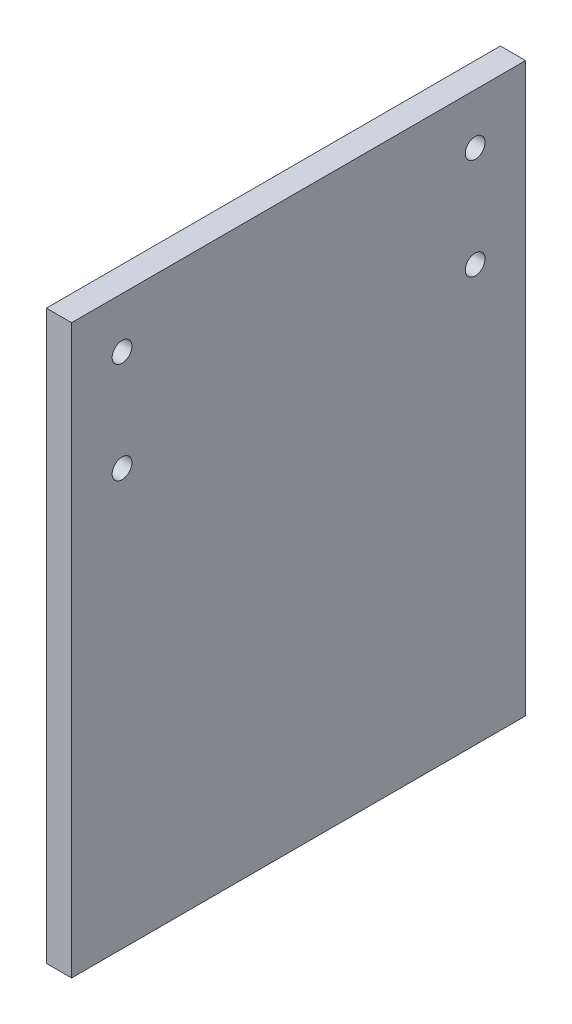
SolidWorks part; units mm, degrees
ref_plane "Front Plane" through (0, 0, 0) normal (0, 0, 1) x (1, 0, 0)
ref_plane "Top Plane" through (0, 0, 0) normal (0, 1, 0) x (1, 0, 0)
ref_plane "Right Plane" through (0, 0, 0) normal (1, 0, 0) x (0, 0, -1)
sketch "Sketch1" plane through (0, 0, 0) normal (1, 0, 0) x (0, 0, -1)
  line L1 (-57.15, 71.4375) -> (57.15, 71.4375)
  line L2 (-57.15, 71.4375) -> (-57.15, -71.4375)
  line L3 (-57.15, -71.4375) -> (57.15, -71.4375)
  line L4 (57.15, 71.4375) -> (57.15, -71.4375)
  line L5 (-57.15, 71.4375) -> (57.15, -71.4375) construction
  line L6 (-57.15, -71.4375) -> (57.15, 71.4375) construction
  point P0 (0, 0)
  dimension "D1" = 114.3
  dimension "D2" = 142.875
extrude "Boss-Extrude1" add sketch "Sketch1" along normal mid plane 6.35
hole_wizard "#10 Clearance Hole2" positions "Sketch3" profile "Sketch2" hole size "#10" standard "ANSI Inch"
sketch "Sketch3" plane through (3.175, 0, 0) normal (1, 0, 0) x (0, 0, -1)
  line L0 (57.15, 71.4375) -> (-57.15, 71.4375) construction
  line L1 (-57.15, 71.4375) -> (-57.15, -71.4375) construction
  line L2 (57.15, -71.4375) -> (57.15, 71.4375) construction
  point P0 (-385.9002, 88.9666)
  point P1 (44.45, 58.7375)
  point P3 (-44.45, 58.7375)
  point P5 (-44.45, 33.3375)
  point P7 (44.45, 33.3375)
  dimension "D1" = 12.7
  dimension "D2" = 12.7
  dimension "D3" = 12.7
  dimension "D4" = 38.1
  dimension "D5" = 88.9
sketch "Sketch2" plane through (3.175, 88.9666, 385.9002) normal (0, 1, 0) x (0, 0, -1)
  line L0 (0, 0) -> (0, 6.35)
  line L1 (0, 6.35) -> (2.4892, 6.35)
  line L2 (2.4892, 6.35) -> (2.4892, 0)
  line L5 (2.4892, 0) -> (0, 0)
  line L11 (0, -6.35) -> (0, 107.95) construction
  dimension "Thru Hole Dia." = 4.9784
  dimension "Thru Hole Depth" = 6.35
equation "\"Buoyancy\"=\"SW-Volume\"*(\"SW-Density\"-.037062)"
